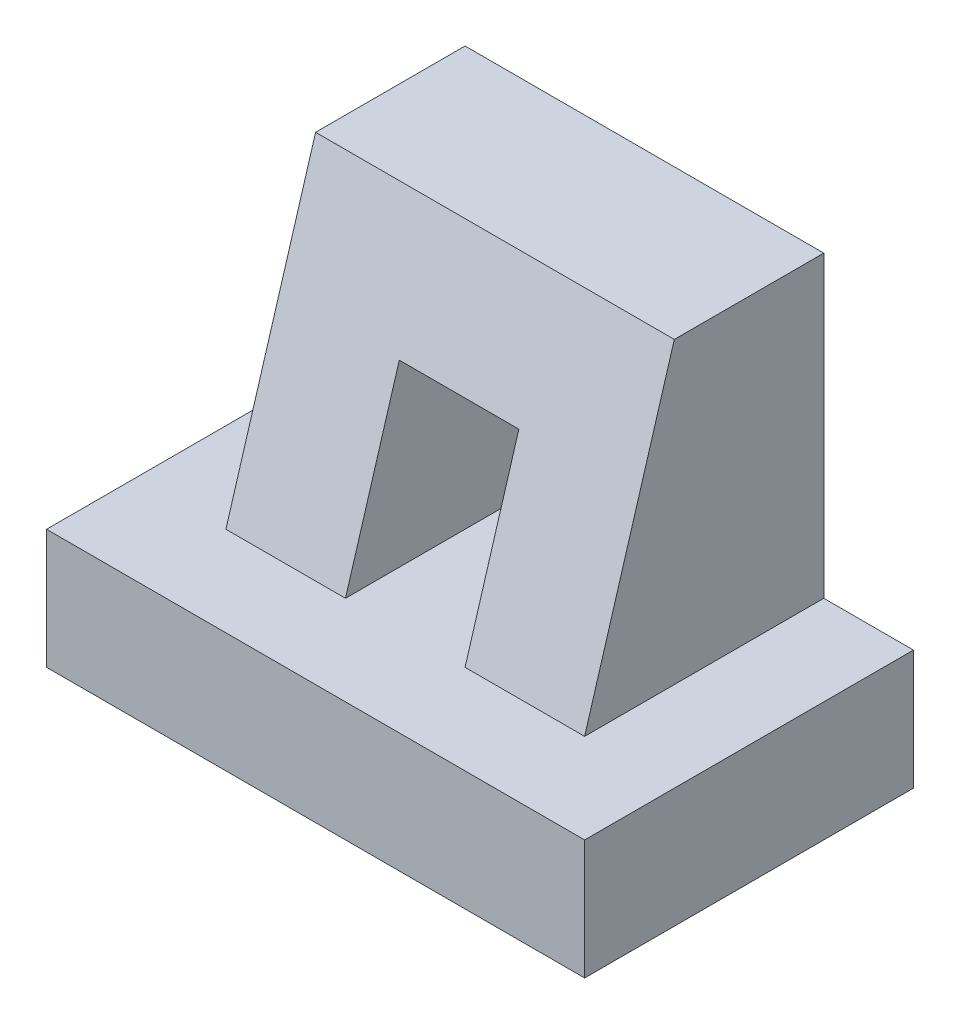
SolidWorks part; units mm, degrees
ref_plane "前视基准面" through (0, 0, 0) normal (0, 0, 1) x (1, 0, 0)
ref_plane "上视基准面" through (0, 0, 0) normal (0, 1, 0) x (1, 0, 0)
ref_plane "右视基准面" through (0, 0, 0) normal (1, 0, 0) x (0, 0, -1)
sketch "草图1" plane through (0, 0, 0) normal (0, 1, 0) x (1, 0, 0)
  line L1 (0, 0) -> (90, 0)
  line L2 (0, 0) -> (0, 55)
  line L3 (0, 55) -> (90, 55)
  line L4 (90, 0) -> (90, 55)
  dimension "D1" = 90
  dimension "D2" = 55
extrude "拉伸1" add sketch "草图1" along normal blind 20
ref_plane "基准面1" through (45, 0, 0) normal (1, 0, 0) x (0, 0, -1)
sketch "草图2" plane through (45, 0, 0) normal (1, 0, 0) x (0, 0, -1)
  line L0 (55, 20) -> (15, 20)
  line L1 (0, 20) -> (55, 20) construction
  line L2 (15, 20) -> (30, 70)
  line L3 (30, 70) -> (55, 70)
  line L4 (55, 70) -> (55, 20)
  dimension "D1" = 50
  dimension "D2" = 40
  dimension "D3" = 25
extrude "拉伸2" add sketch "草图2" along normal mid plane 60
sketch "草图3" plane through (0, 0, 0) normal (0, 0, 1) x (1, 0, 0)
  line L1 (35, 50) -> (55, 50)
  line L2 (35, 50) -> (35, 20)
  line L3 (35, 20) -> (55, 20)
  line L4 (55, 50) -> (55, 20)
  line L5 (0, 20) -> (90, 20) construction
  line L6 (45, 0) -> (45, -7.6149) construction
  line L7 (0, 0) -> (90, 0) construction
  line L8 (75, 70) -> (15, 70) construction
  dimension "D1" = 20
  dimension "D2" = 20
extrude "切除-拉伸1" cut sketch "草图3" against normal through all
